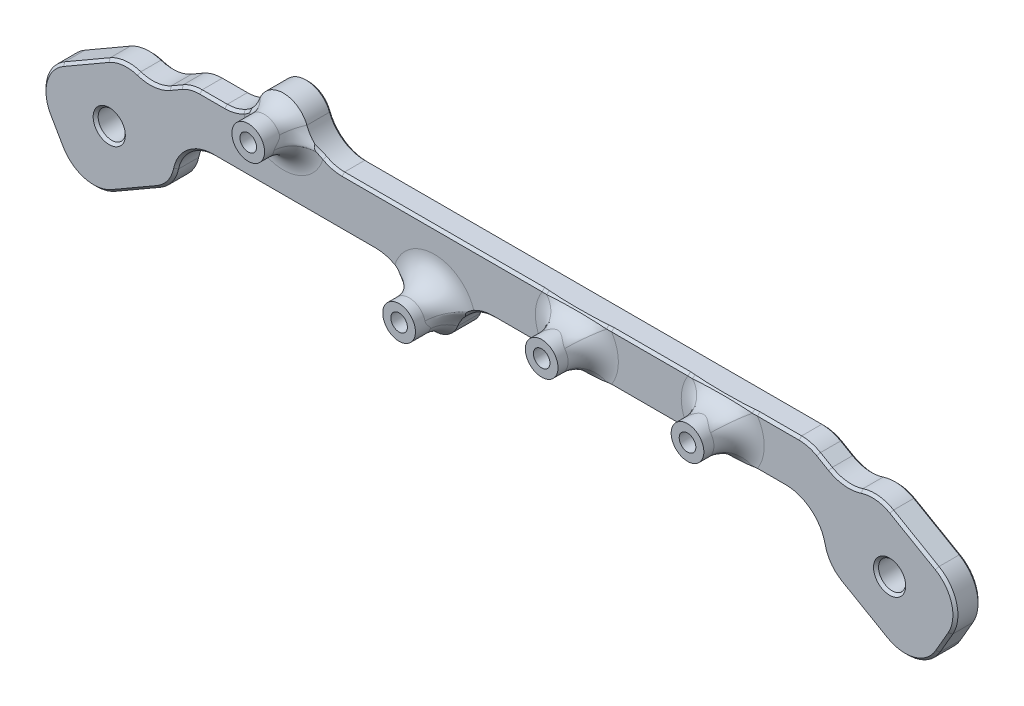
SolidWorks part; units mm, degrees
ref_plane "Płaszczyzna przednia" through (0, 0, 0) normal (0, 0, 1) x (1, 0, 0)
ref_plane "Płaszczyzna górna" through (0, 0, 0) normal (0, 1, 0) x (1, 0, 0)
ref_plane "Płaszczyzna prawa" through (0, 0, 0) normal (1, 0, 0) x (0, 0, -1)
sketch "Szkic1" plane through (0, 0, 0) normal (0, 0, 1) x (1, 0, 0)
  line L0 (-175.087, -102.6153) -> (-135.742, -79.8994)
  line L1 (-135.242, -79.7654) -> (-68.4552, -79.7654)
  line L2 (-67.9552, -79.8994) -> (-28.6101, -102.6153)
  line L3 (87.9258, 107.2308) -> (-54.5742, -139.5864)
  line L4 (-291.6229, 107.2308) -> (-149.1229, -139.5864)
  line L5 (-244.3486, 189.1124) -> (40.6514, 189.1124)
  line L6 (-4.3486, 147.6806) -> (-4.3486, 193.1124)
  line L7 (29.1788, 89.3416) -> (-4.2146, 147.1806)
  line L8 (68.8899, 66.2597) -> (29.5448, 88.9755)
  line L9 (-233.2438, 88.9766) -> (-272.5888, 66.2607)
  line L10 (-217.9311, 115.5197) -> (-210.2311, 128.8565)
  line L11 (-199.3486, 193.1124) -> (-199.3486, 147.6806)
  line L12 (-116.8486, 64.1124) -> (-116.8486, 159.1124)
  line L13 (-84.0774, 59.3126) -> (-1.805, 11.8126)
  line L14 (-99.0774, 33.3318) -> (-16.805, -14.1682)
  line L15 (-186.8922, -14.1682) -> (-104.6197, 33.3318)
  line L16 (-119.6197, 59.3126) -> (-201.8922, 11.8126)
  line L17 (-31.4942, 91.222) -> (-31.4942, 116.772)
  line L18 (-31.4942, 116.772) -> (2.2058, 116.772)
  line L19 (2.2058, 116.772) -> (2.2058, 91.222)
  line L20 (2.2058, 91.222) -> (-31.4942, 91.222)
  line L21 (-70.1424, 91.222) -> (-70.1424, 116.772)
  line L22 (-70.1424, 116.772) -> (-36.4424, 116.772)
  line L23 (-36.4424, 116.772) -> (-36.4424, 91.222)
  line L24 (-36.4424, 91.222) -> (-70.1424, 91.222)
  line L25 (-12.2169, 149.3386) -> (-71.2169, 149.3386)
  line L26 (-74.2169, 152.3386) -> (-74.2169, 176.3386)
  line L27 (-71.2169, 179.3386) -> (-12.2169, 179.3386)
  line L28 (-9.2169, 176.3386) -> (-9.2169, 152.3386)
  line L29 (-199.3486, -27.177) -> (-199.3486, 82.823)
  line L30 (-199.3486, 82.823) -> (-4.3486, 82.823)
  line L31 (-4.3486, 82.823) -> (-4.3486, -27.177)
  line L32 (-4.3486, -27.177) -> (-199.3486, -27.177)
  line L33 (-244.3486, 159.1124) -> (40.6514, 159.1124)
  line L34 (-265.6422, 122.2308) -> (-123.1422, -124.5864)
  line L35 (61.945, 122.2308) -> (-80.555, -124.5864)
  line L36 (-186.3131, 171.0879) -> (-186.3131, 136.0243)
  line L37 (-183.1381, 174.2629) -> (-186.3131, 171.0879)
  line L38 (-84.7131, 174.2629) -> (-183.1381, 174.2629)
  line L39 (-84.7131, 121.0499) -> (-84.7131, 174.2629)
  line L40 (-181.782, 121.0499) -> (-84.7131, 121.0499)
  line L41 (-184.068, 123.3359) -> (-181.782, 121.0499)
  line L42 (-184.068, 133.7792) -> (-184.068, 123.3359)
  line L43 (-186.3131, 136.0243) -> (-184.068, 133.7792)
  line L44 (-148.2984, -39.8299) -> (-151.2984, -39.8299)
  line L45 (-151.2984, -39.8299) -> (-151.2984, -54.3299)
  line L46 (-151.2984, -54.3299) -> (-148.2984, -54.3299)
  line L47 (-148.2984, -54.3299) -> (-148.2984, -57.3299)
  line L48 (-148.2984, -57.3299) -> (-151.2984, -57.3299)
  line L49 (-151.2984, -57.3299) -> (-151.2984, -57.5799)
  line L50 (-151.2984, -57.5799) -> (-108.2984, -57.5799)
  line L51 (-108.2984, -57.5799) -> (-108.2984, -57.3299)
  line L52 (-108.2984, -57.3299) -> (-111.2984, -57.3299)
  line L53 (-111.2984, -57.3299) -> (-111.2984, -54.3299)
  line L54 (-111.2984, -54.3299) -> (-108.2984, -54.3299)
  line L55 (-108.2984, -54.3299) -> (-108.2984, -39.8299)
  line L56 (-108.2984, -39.8299) -> (-111.2984, -39.8299)
  line L57 (-111.2984, -39.8299) -> (-111.2984, -36.8299)
  line L58 (-111.2984, -36.8299) -> (-108.2984, -36.8299)
  line L59 (-108.2984, -36.8299) -> (-108.2984, -36.5799)
  line L60 (-108.2984, -36.5799) -> (-151.2984, -36.5799)
  line L61 (-151.2984, -36.5799) -> (-151.2984, -36.8299)
  line L62 (-151.2984, -36.8299) -> (-148.2984, -36.8299)
  line L63 (-148.2984, -36.8299) -> (-148.2984, -39.8299)
  line L64 (-164.5543, 109.754) -> (-167.5543, 109.754)
  line L65 (-167.5543, 109.754) -> (-167.5543, 95.254)
  line L66 (-167.5543, 95.254) -> (-164.5543, 95.254)
  line L67 (-164.5543, 95.254) -> (-164.5543, 92.254)
  line L68 (-164.5543, 92.254) -> (-167.5543, 92.254)
  line L69 (-167.5543, 92.254) -> (-167.5543, 92.004)
  line L70 (-167.5543, 92.004) -> (-124.5543, 92.004)
  line L71 (-124.5543, 92.004) -> (-124.5543, 92.254)
  line L72 (-124.5543, 92.254) -> (-127.5543, 92.254)
  line L73 (-127.5543, 92.254) -> (-127.5543, 95.254)
  line L74 (-127.5543, 95.254) -> (-124.5543, 95.254)
  line L75 (-124.5543, 95.254) -> (-124.5543, 109.754)
  line L76 (-124.5543, 109.754) -> (-127.5543, 109.754)
  line L77 (-127.5543, 109.754) -> (-127.5543, 112.754)
  line L78 (-127.5543, 112.754) -> (-124.5543, 112.754)
  line L79 (-124.5543, 112.754) -> (-124.5543, 113.004)
  line L80 (-124.5543, 113.004) -> (-167.5543, 113.004)
  line L81 (-167.5543, 113.004) -> (-167.5543, 112.754)
  line L82 (-167.5543, 112.754) -> (-164.5543, 112.754)
  line L83 (-164.5543, 112.754) -> (-164.5543, 109.754)
  line L84 (-86.8486, 64.1124) -> (-86.8486, 159.1124)
  line L85 (-99.3627, 94.6596) -> (-104.5196, 94.6596)
  line L86 (-88.7966, -36.9385) -> (-88.7966, -62.4885)
  line L87 (-88.7966, -62.4885) -> (-55.0966, -62.4885)
  line L88 (-55.0966, -62.4885) -> (-55.0966, -36.9385)
  line L89 (-55.0966, -36.9385) -> (-88.7966, -36.9385)
  circle A0 centre (-86.4466, -49.7135) radius 1.65
  circle A1 centre (-57.4466, -49.7135) radius 1.65
  circle A2 centre (-137.8486, -12.177) radius 1.65
  circle A3 centre (-137.8486, 72.823) radius 1.65
  circle A4 centre (-12.8486, -12.177) radius 1.65
  circle A5 centre (-12.8486, 72.823) radius 1.65
  circle A6 centre (-7.3486, 77.823) radius 2
  circle A7 centre (-194.3486, -22.177) radius 2
  circle A8 centre (-29.1442, 103.997) radius 1.65
  circle A9 centre (-0.1442, 103.997) radius 1.65
  circle A10 centre (-38.7924, 103.997) radius 1.65
  circle A11 centre (-67.7924, 103.997) radius 1.65
  circle A12 centre (-70.7169, 175.8386) radius 1.25
  circle A13 centre (-70.7169, 152.8386) radius 1.25
  circle A14 centre (-12.7169, 175.8386) radius 1.25
  circle A15 centre (-12.7169, 152.8386) radius 1.25
  arc A16 (-74.2169, 152.3386) -> (-71.2169, 149.3386) centre (-71.2169, 152.3386) ccw
  arc A17 (-71.2169, 179.3386) -> (-74.2169, 176.3386) centre (-71.2169, 176.3386) ccw
  arc A18 (-9.2169, 176.3386) -> (-12.2169, 179.3386) centre (-12.2169, 176.3386) ccw
  arc A19 (-12.2169, 149.3386) -> (-9.2169, 152.3386) centre (-12.2169, 152.3386) ccw
  circle A20 centre (-174.8831, 123.4629) radius 1.5875
  circle A21 centre (-181.2331, 171.7229) radius 1.5875
  circle A22 centre (-98.6831, 171.7229) radius 1.5875
  circle A23 centre (-99.9531, 123.4629) radius 1.5875
  circle A24 centre (-144.7984, -39.0799) radius 1.5
  circle A25 centre (-114.7984, -55.0799) radius 1.5
  circle A26 centre (-101.8486, 89.4913) radius 2.7
  arc A27 (-104.5196, 94.6596) -> (-114.4233, 86.0443) centre (-104.5196, 84.6596) ccw
  arc A28 (-90.9081, 89.9999) -> (-99.3627, 94.6596) centre (-99.3627, 84.6596) ccw
  circle A29 centre (-131.0543, 94.504) radius 1.5
  circle A30 centre (-161.0543, 110.504) radius 1.5
  dimension "D1" = 30
sketch "Szkic2" plane through (0, 0, 0) normal (0, 0, 1) x (1, 0, 0)
  line L0 (-195.2629, -54.6697) -> (-185.2629, -71.9902)
  line L1 (-185.2629, -71.9902) -> (-163.6123, -59.4902)
  line L2 (-163.6123, -59.4902) -> (-166.1123, -55.16)
  line L3 (-166.1123, -55.16) -> (-160.7773, -52.0799)
  line L4 (-160.7773, -52.0799) -> (-42.9198, -52.0799)
  line L5 (-42.9198, -52.0799) -> (-37.5849, -55.16)
  line L6 (-37.5849, -55.16) -> (-40.0849, -59.4902)
  line L7 (-40.0849, -59.4902) -> (-18.4342, -71.9902)
  line L8 (-18.4342, -71.9902) -> (-8.4342, -54.6697)
  line L9 (-8.4342, -54.6697) -> (-30.0849, -42.1697)
  line L10 (-30.0849, -42.1697) -> (-32.5849, -46.4998)
  line L11 (-32.5849, -46.4998) -> (-40.2403, -42.0799)
  line L12 (-40.2403, -42.0799) -> (-163.4568, -42.0799)
  line L13 (-163.4568, -42.0799) -> (-171.1123, -46.4998)
  line L14 (-171.1123, -46.4998) -> (-173.6123, -42.1697)
  line L15 (-173.6123, -42.1697) -> (-195.2629, -54.6697)
  line L16 (-291.6229, 107.2308) -> (-149.1229, -139.5864) construction
  line L17 (87.9258, 107.2308) -> (-54.5742, -139.5864) construction
  line L18 (-184.4376, -48.4197) -> (-179.4376, -57.0799) construction
  line L19 (-179.4376, -57.0799) -> (-190.2629, -63.3299) construction
  line L20 (-19.2596, -48.4197) -> (-24.2596, -57.0799) construction
  line L21 (-24.2596, -57.0799) -> (-13.4342, -63.3299) construction
  line L22 (-151.2984, -47.0799) -> (-86.4466, -47.0799) construction
  line L23 (-151.2984, -39.8299) -> (-151.2984, -54.3299) construction
  line L24 (-86.4466, -47.0799) -> (-57.4466, -47.0799) construction
  line L25 (-57.4466, -47.0799) -> (-57.4466, -49.7135) construction
  line L26 (-86.4466, -49.7135) -> (-86.4466, -47.0799) construction
  line L27 (-179.4376, -57.0799) -> (-24.2596, -57.0799) construction
  circle A0 centre (-179.4376, -57.0799) radius 2.7
  circle A1 centre (-24.2596, -57.0799) radius 2.7
  circle A3 centre (-86.4466, -47.0799) radius 1.65
  circle A4 centre (-57.4466, -47.0799) radius 1.65
  dimension "D3" = 5.4
  dimension "D10" = 3.3
  dimension "D1" = 20
  dimension "D2" = 25
  dimension "D4" = 15
  dimension "D5" = 15
  dimension "D6" = 10
  dimension "D7" = 10
  dimension "D8" = 5
  dimension "D9" = 5
extrude "Dodanie-wyciągnięcie1" add sketch "Szkic2" along normal blind 5
sketch "Szkic3" plane through (0, 0, 5) normal (0, 0, 1) x (1, 0, 0)
  line L0 (-144.7984, -39.0799) -> (-144.7984, -42.0799) construction
  line L1 (-40.2403, -42.0799) -> (-163.4568, -42.0799) construction
  line L2 (-139.7984, -39.0799) -> (-139.7984, -42.0799)
  line L3 (-149.7984, -39.0799) -> (-149.7984, -42.0799)
  line L4 (-114.7984, -55.0799) -> (-114.7984, -52.0799) construction
  line L5 (-160.7773, -52.0799) -> (-42.9198, -52.0799) construction
  line L6 (-119.7984, -55.0799) -> (-119.7984, -52.0799)
  line L7 (-109.7984, -55.0799) -> (-109.7984, -52.0799)
  arc A2 (-139.7984, -39.0799) -> (-149.7984, -39.0799) centre (-144.7984, -39.0799) ccw
  arc A3 (-149.7984, -42.0799) -> (-139.7984, -42.0799) centre (-144.7984, -42.0799) ccw
  arc A4 (-119.7984, -55.0799) -> (-109.7984, -55.0799) centre (-114.7984, -55.0799) ccw
  arc A5 (-109.7984, -52.0799) -> (-119.7984, -52.0799) centre (-114.7984, -52.0799) ccw
  point P6 (-144.7984, -40.5799)
  point P12 (-114.7984, -53.5799)
  dimension "D1" = 5
extrude "Dodanie-wyciągnięcie2" add sketch "Szkic3" against normal up to surface (5 mm away)
sketch "Szkic4" plane through (0, 0, 5) normal (0, 0, 1) x (1, 0, 0)
  circle A0 centre (-144.7984, -39.0799) radius 3.25
  circle A1 centre (-114.7984, -55.0799) radius 3.25
  circle A2 centre (-86.4466, -47.0799) radius 3.25
  circle A3 centre (-57.4466, -47.0799) radius 3.25
  circle A4 centre (-57.4466, -47.0799) radius 1.65 construction
  circle A5 centre (-86.4466, -47.0799) radius 1.65 construction
  circle A6 centre (-57.4466, -47.0799) radius 1.65
  circle A7 centre (-86.4466, -47.0799) radius 1.65
  dimension "D1" = 6.5
extrude "Dodanie-wyciągnięcie3" add sketch "Szkic4" along normal blind 7
sketch "Szkic5" plane through (0, 0, 12) normal (0, 0, 1) x (1, 0, 0)
  circle A0 centre (-144.7984, -39.0799) radius 1.65
  circle A1 centre (-114.7984, -55.0799) radius 1.65
  dimension "D1" = 3.3
extrude "Wytnij-wyciągnięcie1" cut sketch "Szkic5" against normal through all
fillet "Zaokrąglenie1" radius 7.5 16 edges at (-30.0849, -42.1697, 2.5) (-40.2403, -42.0799, 2.5) (-8.4342, -54.6697, 2.5) (-18.4342, -71.9902, 2.5) (-40.0849, -59.4902, 2.5) (-42.9198, -52.0799, 2.5) (-119.7984, -52.0799, 2.5) (-160.7773, -52.0799, 2.5) (-109.7984, -52.0799, 2.5) (-149.7984, -42.0799, 2.5) (-139.7984, -42.0799, 2.5) (-163.4568, -42.0799, 2.5) (-173.6123, -42.1697, 2.5) (-163.6123, -59.4902, 2.5) (-195.2629, -54.6697, 2.5) (-185.2629, -71.9902, 2.5)
fillet "Zaokrąglenie2" radius 7.5 4 edges at (-171.1123, -46.4998, 2.5) (-166.1123, -55.16, 2.5) (-37.5849, -55.16, 2.5) (-32.5849, -46.4998, 2.5)
fillet "Zaokrąglenie3" radius 5 4 edges at (-54.1966, -47.0799, 5) (-83.1966, -47.0799, 5) (-111.5484, -55.0799, 5) (-141.5484, -39.0799, 5)
sketch "Szkic6" plane through (0, 0, 0) normal (0, 0, -1) x (-1, 0, 0)
  line L1 (60.7952, -47.0799) -> (59.1209, -44.1799)
  line L2 (59.1209, -44.1799) -> (55.7723, -44.1799)
  line L3 (55.7723, -44.1799) -> (54.098, -47.0799)
  line L4 (54.098, -47.0799) -> (55.7723, -49.9799)
  line L5 (55.7723, -49.9799) -> (59.1209, -49.9799)
  line L6 (59.1209, -49.9799) -> (60.7952, -47.0799)
  line L7 (89.7952, -47.0799) -> (88.1209, -44.1799)
  line L8 (88.1209, -44.1799) -> (84.7723, -44.1799)
  line L9 (84.7723, -44.1799) -> (83.098, -47.0799)
  line L10 (83.098, -47.0799) -> (84.7723, -49.9799)
  line L11 (84.7723, -49.9799) -> (88.1209, -49.9799)
  line L12 (88.1209, -49.9799) -> (89.7952, -47.0799)
  line L13 (118.1471, -55.0799) -> (116.4727, -52.1799)
  line L14 (116.4727, -52.1799) -> (113.1241, -52.1799)
  line L15 (113.1241, -52.1799) -> (111.4498, -55.0799)
  line L16 (111.4498, -55.0799) -> (113.1241, -57.9799)
  line L17 (113.1241, -57.9799) -> (116.4727, -57.9799)
  line L18 (116.4727, -57.9799) -> (118.1471, -55.0799)
  line L19 (144.7984, -42.4285) -> (147.6984, -40.7542)
  line L20 (147.6984, -40.7542) -> (147.6984, -37.4056)
  line L21 (147.6984, -37.4056) -> (144.7984, -35.7313)
  line L22 (144.7984, -35.7313) -> (141.8984, -37.4056)
  line L23 (141.8984, -37.4056) -> (141.8984, -40.7542)
  line L24 (141.8984, -40.7542) -> (144.7984, -42.4285)
  circle A0 centre (57.4466, -47.0799) radius 2.9 construction
  circle A1 centre (86.4466, -47.0799) radius 2.9 construction
  circle A2 centre (114.7984, -55.0799) radius 2.9 construction
  circle A3 centre (144.7984, -39.0799) radius 2.9 construction
  dimension "D1" = 5.8
extrude "Wytnij-wyciągnięcie2" cut sketch "Szkic6" against normal blind 2.8
chamfer "Sfazowanie2" distance 0.6 angle 65 4 edges at (-146.4484, -39.0799, 2.8) (-116.4484, -55.0799, 2.8) (-88.0966, -47.0799, 2.8) (-59.0966, -47.0799, 2.8)
chamfer "Sfazowanie1" distance 0.5 angle 45 106 edges at (-21.5596, -57.0799, 0) (-176.7376, -57.0799, 0) (-40.3088, -42.3355, 0) (-87.6932, -42.0799, 0) (-137.3792, -40.7646, 0) (-144.7984, -34.0799, 0) (-152.2177, -40.7646, 0) (-158.9538, -42.0799, 0) (-163.3883, -42.3355, 0) (-166.3754, -43.7649, 0) (-170.5319, -45.4102, 0) (-176.7576, -44.7402, 0) (-184.2518, -48.3124, 0) (-192.2621, -55.4737, 0) (-190.2629, -63.3299, 0) (-184.4588, -68.9894, 0) (-174.2518, -65.6329, 0) (-167.4111, -60.9289, 0) (-164.8784, -55.2023, 0) (-162.5356, -53.0951, 0) (-160.7088, -52.3355, 0) (-142.614, -52.0799, 0) (-122.2177, -53.3953, 0) (-114.7984, -60.0799, 0) (-107.3792, -53.3953, 0) (-74.033, -52.0799, 0) (-42.9883, -52.3355, 0) (-41.1615, -53.0951, 0) (-38.8187, -55.2023, 0) (-36.2861, -60.9289, 0) (-29.4453, -65.6329, 0) (-19.2383, -68.9894, 0) (-13.4342, -63.3299, 0) (-11.435, -55.4737, 0) (-19.4453, -48.3124, 0) (-26.9395, -44.7402, 0) (-33.1652, -45.4102, 0) (-37.3218, -43.7649, 0) (-158.9538, -42.0799, 5) (-163.3883, -42.3355, 5) (-166.3754, -43.7649, 5) (-170.5319, -45.4102, 5) (-176.7576, -44.7402, 5) (-142.614, -52.0799, 5) (-184.2518, -48.3124, 5) (-160.7088, -52.3355, 5) (-192.2621, -55.4737, 5) (-162.5356, -53.0951, 5) (-190.2629, -63.3299, 5) (-164.8784, -55.2023, 5) (-184.4588, -68.9894, 5) (-167.4111, -60.9289, 5) (-174.2518, -65.6329, 5) (-113.0727, -42.0799, 5) (-86.4466, -42.0799, 5) (-98.0727, -52.0799, 5) (-71.9466, -42.0799, 5) (-86.4466, -52.0799, 5) (-57.4466, -42.0799, 5) (-71.9466, -52.0799, 5) (-46.5672, -42.0799, 5) (-57.4466, -52.0799, 5) (-40.3088, -42.3355, 5) (-47.9069, -52.0799, 5) (-37.3218, -43.7649, 5) (-42.9883, -52.3355, 5) (-33.1652, -45.4102, 5) (-41.1615, -53.0951, 5) (-26.9395, -44.7402, 5) (-38.8187, -55.2023, 5) (-19.4453, -48.3124, 5) (-36.2861, -60.9289, 5) (-11.435, -55.4737, 5) (-29.4453, -65.6329, 5) (-13.4342, -63.3299, 5) (-19.2383, -68.9894, 5) (-21.5596, -57.0799, 5) (-176.7376, -57.0799, 5) (-147.6984, -39.0799, 0) (-146.2484, -36.5684, 0) (-143.3484, -36.5684, 0) (-141.8984, -39.0799, 0) (-143.3484, -41.5914, 0) (-146.2484, -41.5914, 0) (-114.7984, -52.1799, 0) (-112.2869, -53.6299, 0) (-112.2869, -56.5299, 0) (-114.7984, -57.9799, 0) (-117.3099, -56.5299, 0) (-117.3099, -53.6299, 0) (-86.4466, -44.1799, 0) (-83.9351, -45.6299, 0) (-83.9351, -48.5299, 0) (-86.4466, -49.9799, 0) (-88.9581, -48.5299, 0) (-88.9581, -45.6299, 0) (-57.4466, -44.1799, 0) (-54.9351, -45.6299, 0) (-54.9351, -48.5299, 0) (-57.4466, -49.9799, 0) (-59.9581, -48.5299, 0) (-59.9581, -45.6299, 0)
